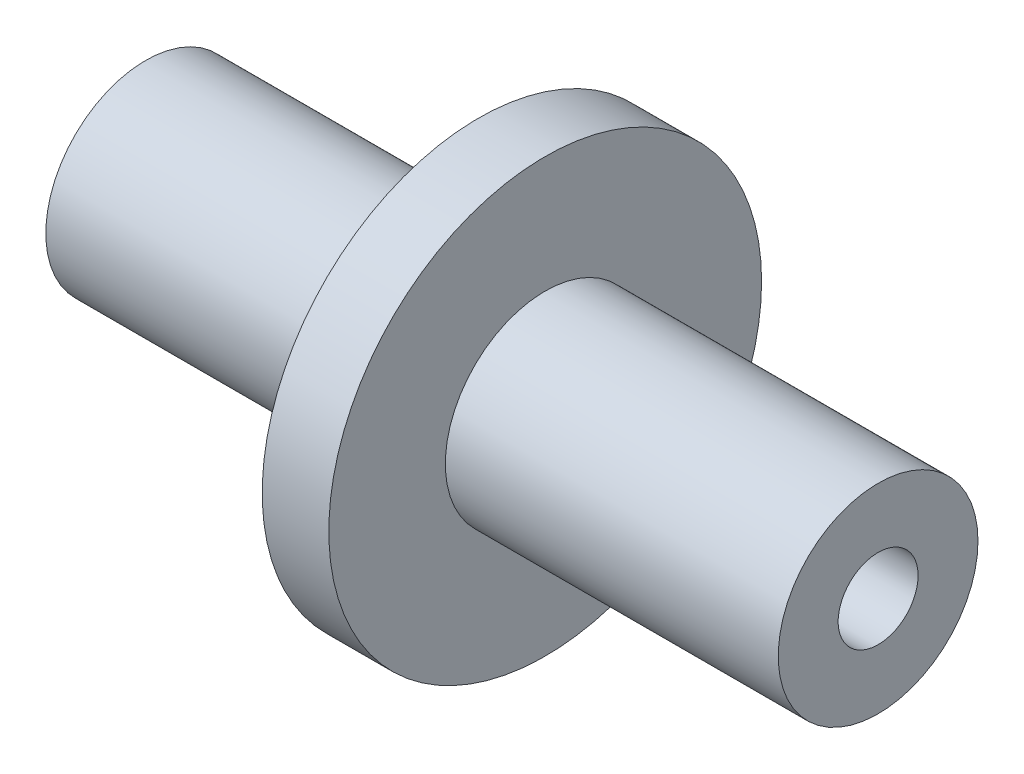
SolidWorks part; units mm, degrees
ref_plane "Plan de face" through (0, 0, 0) normal (0, 0, 1) x (1, 0, 0)
ref_plane "Plan de dessus" through (0, 0, 0) normal (0, 1, 0) x (1, 0, 0)
ref_plane "Plan de droite" through (0, 0, 0) normal (1, 0, 0) x (0, 0, -1)
sketch "Esquisse2" plane through (0, 0, 0) normal (0, 1, 0) x (1, 0, 0)
  line L0 (4.6008, -3.75) -> (-17.8598, -3.75) construction
  line L5 (-5, -2.25) -> (-10, -2.25)
  line L7 (-10, -2.25) -> (-10, -0.5)
  line L8 (-10, -0.5) -> (-11, -0.5)
  line L9 (-11, -0.5) -> (-11, -2.25)
  line L10 (-11, -2.25) -> (-16, -2.25)
  line L11 (-16, -2.25) -> (-16, -3.15)
  line L12 (-16, -3.15) -> (-5, -3.15)
  line L13 (-5, -3.15) -> (-5, -2.25)
  dimension "D1" = 1
  dimension "D2" = 5
  dimension "D3" = 5
  dimension "D4" = 1.2
revolve "Révolution1" add sketch "Esquisse2" angle 360 about L0
